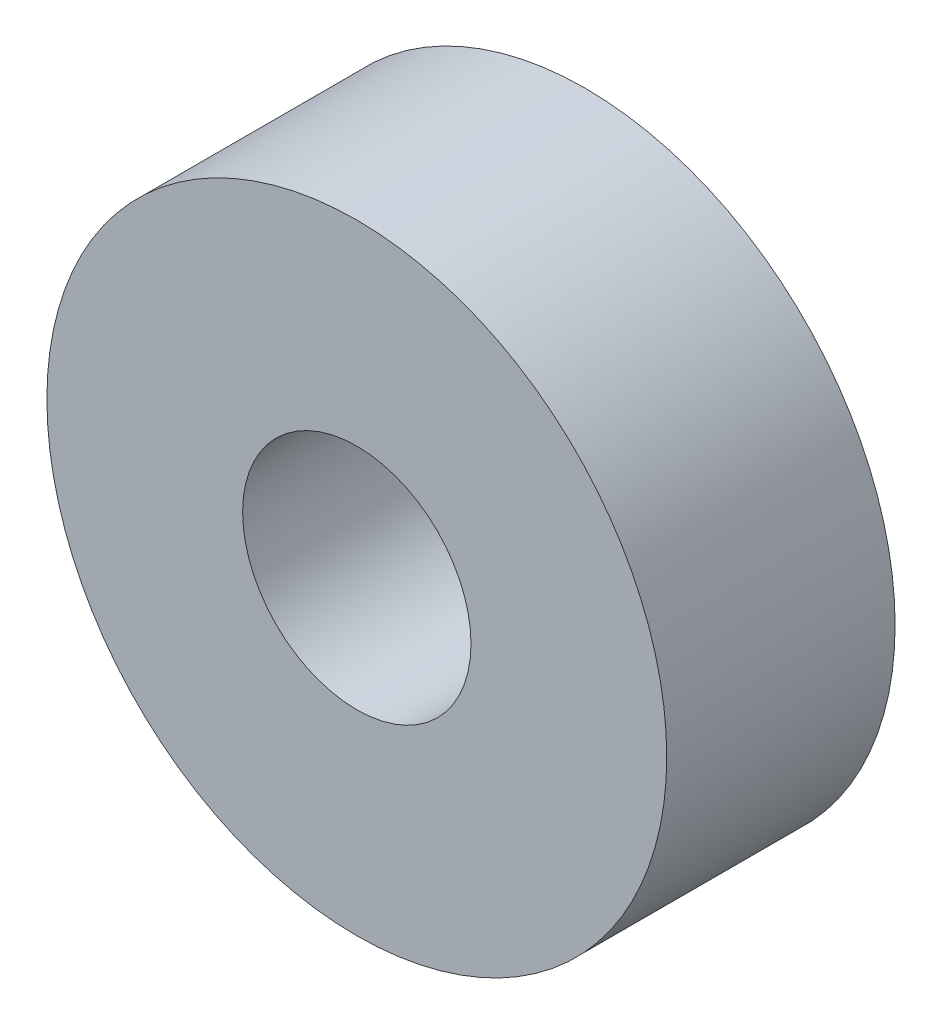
SolidWorks part; units mm, degrees
ref_plane "Front Plane" through (0, 0, 0) normal (0, 0, 1) x (1, 0, 0)
ref_plane "Top Plane" through (0, 0, 0) normal (0, 1, 0) x (1, 0, 0)
ref_plane "Right Plane" through (0, 0, 0) normal (1, 0, 0) x (0, 0, -1)
sketch "Sketch1" plane through (0, 0, 0) normal (0, 0, 1) x (1, 0, 0)
  circle A0 centre (0, 0) radius 1.75
  circle A1 centre (0, 0) radius 4.75
  dimension "D1" = 3.5
  dimension "D2" = 9.5
extrude "Extrude1" add sketch "Sketch1" along normal blind 3.5
